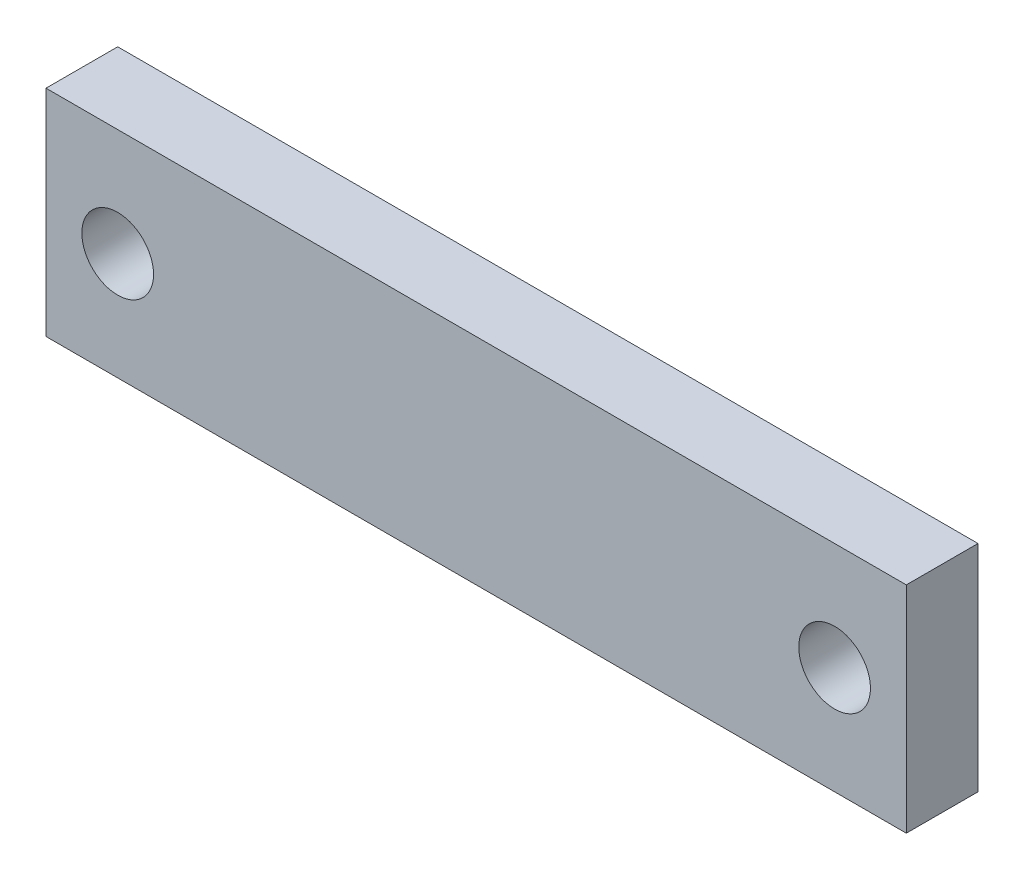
SolidWorks part; units mm, degrees
ref_plane "Ebene vorne" through (0, 0, 0) normal (0, 0, 1) x (1, 0, 0)
ref_plane "Ebene oben" through (0, 0, 0) normal (0, 1, 0) x (1, 0, 0)
ref_plane "Ebene rechts" through (0, 0, 0) normal (1, 0, 0) x (0, 0, -1)
sketch "Skizze1" plane through (0, 0, 0) normal (0, 0, 1) x (1, 0, 0)
  line L1 (-100, 30) -> (20, 30)
  line L2 (-100, 30) -> (-100, 0)
  line L3 (-100, 0) -> (20, 0)
  line L4 (20, 30) -> (20, 0)
  circle A0 centre (-90, 15) radius 5
  circle A1 centre (10, 15) radius 5
  dimension "D3" = 10
  dimension "D4" = 10
  dimension "D1" = 30
  dimension "D2" = 15
  dimension "D5" = 10
  dimension "D6" = 100
  dimension "D7" = 15
  dimension "D8" = 10
extrude "Linear austragen1" add sketch "Skizze1" along normal blind 10
